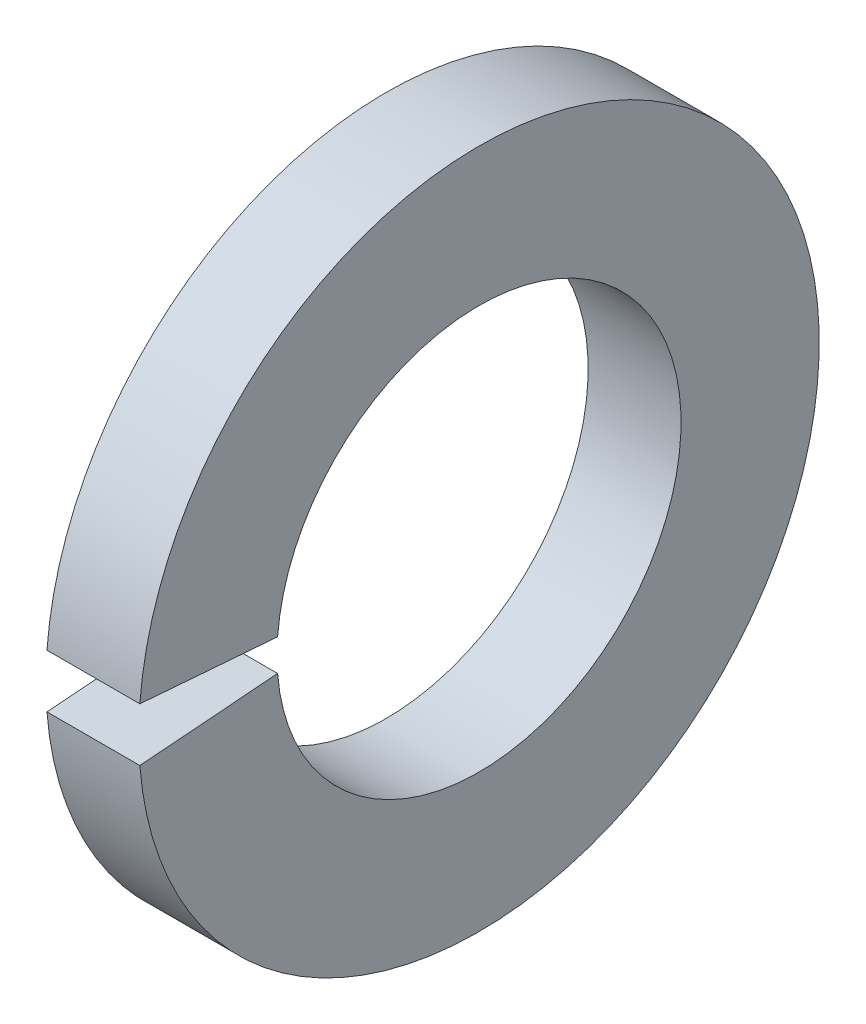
SolidWorks part; units mm, degrees
ref_plane "Plane1" through (0, 0, 0) normal (0, 0, 1) x (1, 0, 0)
ref_plane "Plane2" through (0, 0, 0) normal (0, 1, 0) x (1, 0, 0)
ref_plane "Plane3" through (0, 0, 0) normal (1, 0, 0) x (0, 0, -1)
sketch "Sketch1" plane through (0, 0, 0) normal (0, 0, 1) x (1, 0, 0)
  line L0 (-34.925, 0) -> (9.525, 0) construction
  line L1 (0, 2.2098) -> (0, 3.7211)
  line L2 (0, 3.7211) -> (-1.016, 3.7211)
  line L3 (-1.016, 3.7211) -> (-1.016, 2.2098)
  line L4 (-1.016, 2.2098) -> (0, 2.2098)
revolve "Base-Revolve" add sketch "Sketch1" angle 360 about L0
sketch "Sketch2" plane through (0, 0, 0) normal (-1, 0, 0) x (0, -1, 0)
  line L0 (0, 0) -> (0.2978, 3.7838)
  line L1 (0, -3.175) -> (0, 12.7) construction
  line L2 (0, 0) -> (-0.2978, 3.7838)
  arc A0 (0.2978, 3.7838) -> (-0.2978, 3.7838) centre (0, 0) ccw
extrude "Gap" cut sketch "Sketch2" along normal through all
equation "\"D1@Sketch2\" = \"Outside_dia@Sketch1\" * 0.51"
